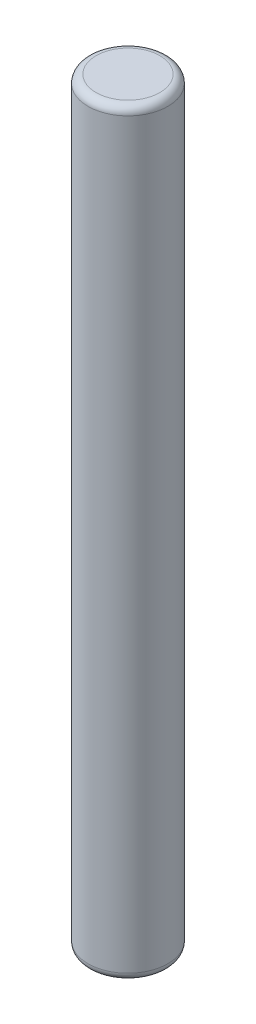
SolidWorks part; units mm, degrees
ref_plane "Front Plane" through (0, 0, 0) normal (0, 0, 1) x (1, 0, 0)
ref_plane "Top Plane" through (0, 0, 0) normal (0, 1, 0) x (1, 0, 0)
ref_plane "Right Plane" through (0, 0, 0) normal (1, 0, 0) x (0, 0, -1)
sketch "Sketch1" plane through (0, 0, 0) normal (0, 1, 0) x (1, 0, 0)
  circle A0 centre (0, 0) radius 2.5
extrude "Boss-Extrude1" add sketch "Sketch1" along normal blind 47.5
fillet "Fillet1" radius 0.5 2 edges at (0, 0, 2.5) (0, 47.5, 2.5)
